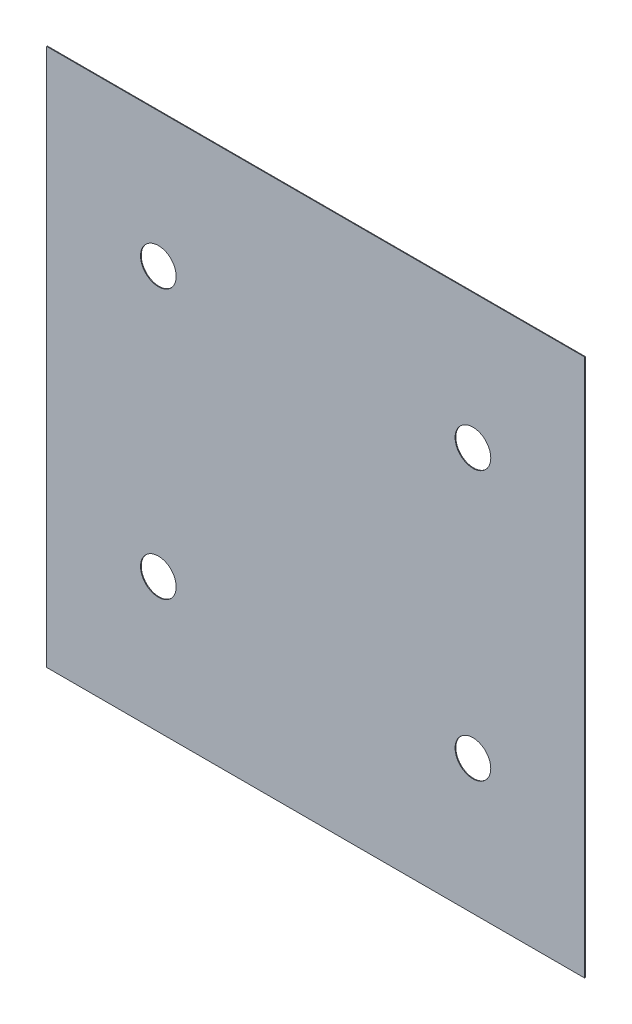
SolidWorks part; units mm, degrees
ref_plane "Front Plane" through (0, 0, 0) normal (0, 0, 1) x (1, 0, 0)
ref_plane "Top Plane" through (0, 0, 0) normal (0, 1, 0) x (1, 0, 0)
ref_plane "Right Plane" through (0, 0, 0) normal (1, 0, 0) x (0, 0, -1)
sketch "Sketch1" plane through (0, 0, 0) normal (0, 0, 1) x (1, 0, 0)
  line L1 (-598.4875, 598.4875) -> (598.4875, 598.4875)
  line L2 (-598.4875, 598.4875) -> (-598.4875, -598.4875)
  line L3 (-598.4875, -598.4875) -> (598.4875, -598.4875)
  line L4 (598.4875, 598.4875) -> (598.4875, -598.4875)
  point P4 (0, 598.4875)
  point P5 (-598.4875, 0)
  dimension "D1" = 1196.975
  dimension "D2" = 1196.975
sketch "Sketch2" plane through (0, 0, 0) normal (0, 0, 1) x (1, 0, 0)
  line L0 (-598.4875, 598.4875) -> (-598.4875, -598.4875) construction
  line L1 (-598.4875, -598.4875) -> (598.4875, -598.4875) construction
  line L2 (598.4875, 598.4875) -> (598.4875, -598.4875) construction
  circle A1 centre (574.3575, -574.3575) radius 4.9022
  circle A2 centre (-574.3575, -574.3575) radius 4.9022
  circle A3 centre (574.3575, -524.4134) radius 4.9022
  circle A4 centre (-574.3575, -524.4134) radius 4.9022
  circle A5 centre (574.3575, -474.4692) radius 4.9022
  circle A6 centre (-574.3575, -474.4692) radius 4.9022
  circle A7 centre (574.3575, -424.5251) radius 4.9022
  circle A8 centre (-574.3575, -424.5251) radius 4.9022
  circle A9 centre (574.3575, -374.581) radius 4.9022
  circle A10 centre (-574.3575, -374.581) radius 4.9022
  circle A11 centre (574.3575, -324.6368) radius 4.9022
  circle A12 centre (-574.3575, -324.6368) radius 4.9022
  circle A13 centre (574.3575, -274.6927) radius 4.9022
  circle A14 centre (-574.3575, -274.6927) radius 4.9022
  circle A15 centre (574.3575, -224.7486) radius 4.9022
  circle A16 centre (-574.3575, -224.7486) radius 4.9022
  circle A17 centre (574.3575, -174.8045) radius 4.9022
  circle A18 centre (-574.3575, -174.8045) radius 4.9022
  circle A19 centre (574.3575, -124.8603) radius 4.9022
  circle A20 centre (-574.3575, -124.8603) radius 4.9022
  circle A21 centre (574.3575, -74.9162) radius 4.9022
  circle A22 centre (-574.3575, -74.9162) radius 4.9022
  circle A23 centre (574.3575, -24.9721) radius 4.9022
  circle A24 centre (-574.3575, -24.9721) radius 4.9022
  circle A25 centre (574.3575, 24.9721) radius 4.9022
  circle A26 centre (-574.3575, 24.9721) radius 4.9022
  circle A27 centre (574.3575, 74.9162) radius 4.9022
  circle A28 centre (-574.3575, 74.9162) radius 4.9022
  circle A29 centre (574.3575, 124.8603) radius 4.9022
  circle A30 centre (-574.3575, 124.8603) radius 4.9022
  circle A31 centre (574.3575, 174.8045) radius 4.9022
  circle A32 centre (-574.3575, 174.8045) radius 4.9022
  circle A33 centre (574.3575, 224.7486) radius 4.9022
  circle A34 centre (-574.3575, 224.7486) radius 4.9022
  circle A35 centre (574.3575, 274.6927) radius 4.9022
  circle A36 centre (-574.3575, 274.6927) radius 4.9022
  circle A37 centre (574.3575, 324.6368) radius 4.9022
  circle A38 centre (-574.3575, 324.6368) radius 4.9022
  circle A39 centre (574.3575, 374.581) radius 4.9022
  circle A40 centre (-574.3575, 374.581) radius 4.9022
  circle A41 centre (574.3575, 424.5251) radius 4.9022
  circle A42 centre (-574.3575, 424.5251) radius 4.9022
  circle A43 centre (574.3575, 474.4692) radius 4.9022
  circle A44 centre (-574.3575, 474.4692) radius 4.9022
  circle A45 centre (574.3575, 524.4134) radius 4.9022
  circle A46 centre (-574.3575, 524.4134) radius 4.9022
  circle A47 centre (574.3575, 574.3575) radius 4.9022
  circle A48 centre (-574.3575, 574.3575) radius 4.9022
  circle A49 centre (-524.4134, -574.3575) radius 4.9022
  circle A50 centre (-524.4134, 574.3575) radius 4.9022
  circle A51 centre (-474.4692, -574.3575) radius 4.9022
  circle A52 centre (-474.4692, 574.3575) radius 4.9022
  circle A53 centre (-424.5251, -574.3575) radius 4.9022
  circle A54 centre (-424.5251, 574.3575) radius 4.9022
  circle A55 centre (-374.581, -574.3575) radius 4.9022
  circle A56 centre (-374.581, 574.3575) radius 4.9022
  circle A57 centre (-324.6368, -574.3575) radius 4.9022
  circle A58 centre (-324.6368, 574.3575) radius 4.9022
  circle A59 centre (-274.6927, -574.3575) radius 4.9022
  circle A60 centre (-274.6927, 574.3575) radius 4.9022
  circle A61 centre (-224.7486, -574.3575) radius 4.9022
  circle A62 centre (-224.7486, 574.3575) radius 4.9022
  circle A63 centre (-174.8045, -574.3575) radius 4.9022
  circle A64 centre (-174.8045, 574.3575) radius 4.9022
  circle A65 centre (-124.8603, -574.3575) radius 4.9022
  circle A66 centre (-124.8603, 574.3575) radius 4.9022
  circle A67 centre (-74.9162, -574.3575) radius 4.9022
  circle A68 centre (-74.9162, 574.3575) radius 4.9022
  circle A69 centre (-24.9721, -574.3575) radius 4.9022
  circle A70 centre (-24.9721, 574.3575) radius 4.9022
  circle A71 centre (24.9721, -574.3575) radius 4.9022
  circle A72 centre (24.9721, 574.3575) radius 4.9022
  circle A73 centre (74.9162, -574.3575) radius 4.9022
  circle A74 centre (74.9162, 574.3575) radius 4.9022
  circle A75 centre (124.8603, -574.3575) radius 4.9022
  circle A76 centre (124.8603, 574.3575) radius 4.9022
  circle A77 centre (174.8045, -574.3575) radius 4.9022
  circle A78 centre (174.8045, 574.3575) radius 4.9022
  circle A79 centre (224.7486, -574.3575) radius 4.9022
  circle A80 centre (224.7486, 574.3575) radius 4.9022
  circle A81 centre (274.6927, -574.3575) radius 4.9022
  circle A82 centre (274.6927, 574.3575) radius 4.9022
  circle A83 centre (324.6368, -574.3575) radius 4.9022
  circle A84 centre (324.6368, 574.3575) radius 4.9022
  circle A85 centre (374.581, -574.3575) radius 4.9022
  circle A86 centre (374.581, 574.3575) radius 4.9022
  circle A87 centre (424.5251, -574.3575) radius 4.9022
  circle A88 centre (424.5251, 574.3575) radius 4.9022
  circle A89 centre (474.4692, -574.3575) radius 4.9022
  circle A90 centre (474.4692, 574.3575) radius 4.9022
  circle A91 centre (524.4134, -574.3575) radius 4.9022
  circle A92 centre (524.4134, 574.3575) radius 4.9022
  dimension "D1" = 24.13
  dimension "D3" = 9.8044
  dimension "D6" = 9.8044
  dimension "D2" = 24.13
  dimension "D4" = 24.13
  dimension "D5" = 24.13
  dimension "D8" = 23
  dimension "D7" = 24
extrude "Boss-Extrude1" add sketch "Sketch1" along normal blind 1.5875
extrude "Cut-Extrude2" [suppressed] cut sketch "Sketch2" along normal through all
sketch "Sketch3" plane through (0, 0, 0) normal (0, 0, 1) x (1, 0, 0)
  line L1 (-646.4427, 658.8125) -> (547.3573, 658.8125)
  line L2 (-646.4427, 658.8125) -> (-646.4427, -534.9875)
  line L3 (-646.4427, -534.9875) -> (547.3573, -534.9875)
  line L4 (547.3573, 658.8125) -> (547.3573, -534.9875)
  line L6 (598.4875, 598.4875) -> (-598.4875, 598.4875) construction
  line L7 (-598.4875, 598.4875) -> (-598.4875, -598.4875) construction
  line L8 (547.3573, 547.6875) -> (-550.2275, 547.6875)
  line L9 (-550.2275, 547.6875) -> (-550.2275, -534.9875)
  dimension "D1" = 547.3573
  dimension "D2" = 534.9875
  dimension "D3" = 60.325
  dimension "D4" = 47.9552
  dimension "D5" = 50.8
  dimension "D6" = 48.26
sketch "Sketch4" plane through (0, 0, 0) normal (0, 0, 1) x (1, 0, 0)
  line L0 (-550.2275, 547.6875) -> (-550.2275, -534.9875) construction
  line L1 (-646.4427, -534.9875) -> (547.3573, -534.9875) construction
  line L2 (547.3573, 547.6875) -> (-550.2275, 547.6875) construction
  line L3 (547.3573, 658.8125) -> (547.3573, -534.9875) construction
  circle A3 centre (-518.2007, -458.7875) radius 11.1125
  circle A4 centre (-474.0275, -502.9607) radius 11.1125
  circle A9 centre (515.3305, 471.4875) radius 11.1125
  circle A10 centre (471.1573, 515.6607) radius 11.1125
  circle A12 centre (-518.2007, -458.7875) radius 15.5054 construction
  circle A13 centre (-474.0275, -502.9607) radius 15.5054 construction
  circle A14 centre (471.1573, 515.6607) radius 15.5054 construction
  circle A15 centre (515.3305, 471.4875) radius 15.5054 construction
  circle A16 centre (-518.2007, -226.2187) radius 11.1125
  circle A17 centre (-518.2007, 6.35) radius 11.1125
  circle A18 centre (-518.2007, 238.9188) radius 11.1125
  circle A19 centre (-518.2007, 471.4875) radius 11.1125
  circle A20 centre (-237.7313, -502.9607) radius 11.1125
  circle A21 centre (-1.4351, -502.9607) radius 11.1125
  circle A22 centre (234.8611, -502.9607) radius 11.1125
  circle A23 centre (471.1573, -502.9607) radius 11.1125
  circle A24 centre (234.8611, 515.6607) radius 11.1125
  circle A25 centre (-1.4351, 515.6607) radius 11.1125
  circle A26 centre (-237.7313, 515.6607) radius 11.1125
  circle A27 centre (-474.0275, 515.6607) radius 11.1125
  circle A28 centre (515.3305, 238.9188) radius 11.1125
  circle A29 centre (515.3305, 6.35) radius 11.1125
  circle A30 centre (515.3305, -226.2187) radius 11.1125
  circle A31 centre (515.3305, -458.7875) radius 11.1125
  dimension "D1" = 22.225
  dimension "D2" = 22.225
  dimension "D3" = 31.0108
  dimension "D4" = 31.0108
  dimension "D5" = 76.2
  dimension "D6" = 76.2
  dimension "D7" = 22.225
  dimension "D8" = 22.225
  dimension "D9" = 32.0268
  dimension "D10" = 32.0268
  dimension "D11" = 5
  dimension "D12" = 5
  dimension "D13" = 31.0108
  dimension "D16" = 31.0108
  dimension "D14" = 32.0268
  dimension "D15" = 76.2
  dimension "D17" = 32.0268
  dimension "D18" = 76.2
  dimension "D19" = 5
  dimension "D20" = 5
extrude "Cut-Extrude3" [suppressed] cut sketch "Sketch4" along normal blind 25.4
sketch "Sketch5" plane through (0, 0, 0) normal (0, 0, 1) x (1, 0, 0)
  circle A0 centre (-350.0437, 299.2437) radius 39.6875
  circle A1 centre (-350.0437, -299.2437) radius 39.6875
  circle A2 centre (350.0437, 299.2437) radius 39.6875
  circle A3 centre (350.0438, -299.2437) radius 39.6875
  point P8 (0, 0)
  point P10 (0, 0)
  point P11 (0, 0)
  point P12 (0, 0)
  dimension "D5" = 79.375
  dimension "D6" = 79.375
  dimension "D7" = 79.375
  dimension "D8" = 79.375
  dimension "D1" = 350.0437
  dimension "D2" = 350.0437
  dimension "D3" = 299.2437
  dimension "D4" = 299.2437
extrude "Cut-Extrude4" cut sketch "Sketch5" along normal blind 2.54
